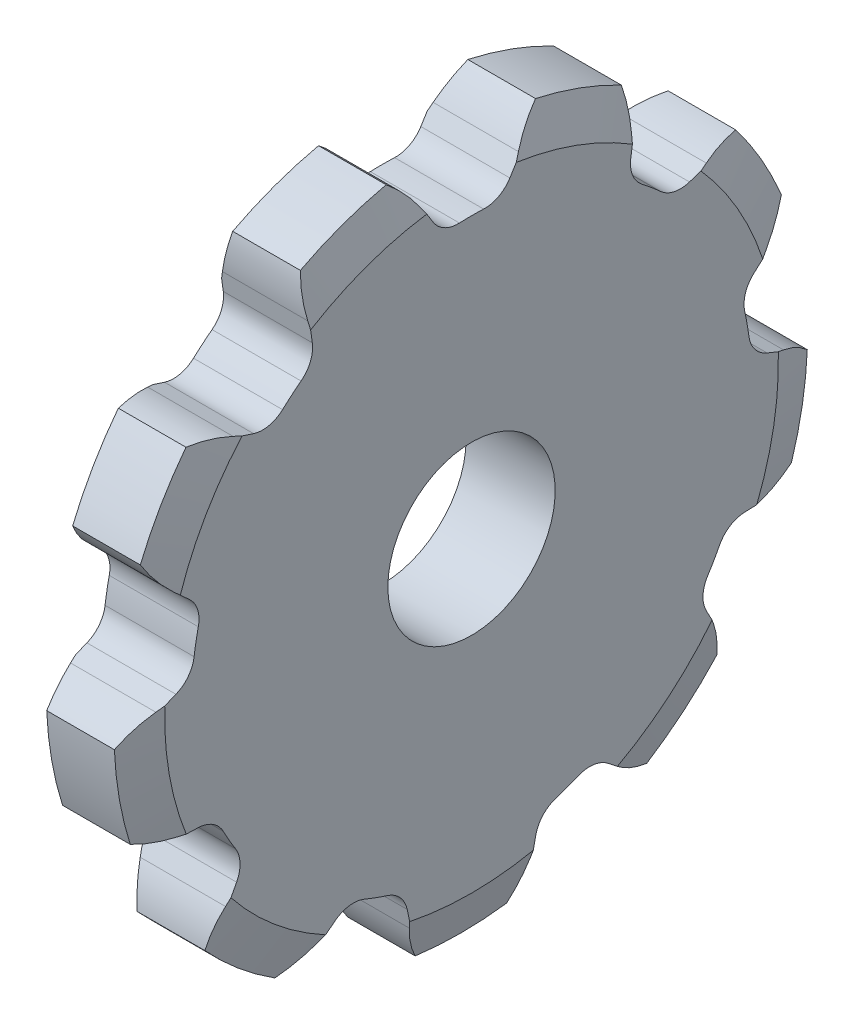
SolidWorks part; units mm, degrees
ref_plane "Plane1" through (0, 0, 0) normal (0, 0, 1) x (1, 0, 0)
ref_plane "Plane2" through (0, 0, 0) normal (0, 1, 0) x (1, 0, 0)
ref_plane "Plane3" through (0, 0, 0) normal (1, 0, 0) x (0, 0, -1)
sketch "Clipboard" plane through (0, 0, 0) normal (0, 1, 0) x (1, 0, 0)
  line L0 (0, 0) -> (65.4527, -10.3667)
  line L1 (-15, 0) -> (100, 0) construction
  line L2 (0, 0) -> (-2.1039, 2.3779)
  line L3 (0, 0) -> (-11.863, 4.5341)
  line L4 (0, 0) -> (8.5297, 1.351)
  line L5 (0, 0) -> (-71.3958, -26.6285)
  line L6 (0, 0) -> (-22.4032, -15.1155)
  line L7 (-2.1039, 2.3779) -> (14.2981, 76.7917)
  line L8 (-76.2, 54.61) -> (-19.7358, 54.61)
  line L9 (-66.6514, 23.5599) -> (-55.7196, 25.8835)
  line L10 (-76.2, 71.12) -> (20.6782, 71.12)
  line L11 (0, 0) -> (-28.448, 0)
  line L12 (-76.2, 101.6) -> (-47.752, 101.6)
  circle A0 centre (0, 0) radius 11.176
  circle A1 centre (0, 0) radius 25.4
  circle A2 centre (0, 0) radius 25.4
  dimension "MHD" = 50.8
  dimension "Hub_dia" = 50.8
  dimension "Diameter" = 22.352
  dimension "Num_teeth" = 9
  dimension "Pitch_radius" = 96.8782
  dimension "Pitch" = 66.2686
  dimension "Width" = 28.448
  dimension "Overall_len" = 76.2
  dimension "Show_teeth" = 9
  dimension "Thickness" = 27.0256
  dimension "OAL" = 76.2001
  dimension "T_dim" = 56.4642
  dimension "Ap" = 12
  dimension "H" = 11.176
  dimension "F" = 28.448
sketch "BasProSke" plane through (0, 0, 0) normal (0, 1, 0) x (1, 0, 0)
  line L0 (-10, 0) -> (60, 0) construction
  line L1 (0, 0) -> (0, 93.1564)
  line L2 (0, 0) -> (27.0256, 0)
  line L3 (27.0256, 0) -> (27.0256, 93.1564)
  line L4 (23.7825, 105.2597) -> (3.2431, 105.2597)
  line L5 (0, 93.1564) -> (3.2431, 105.2597)
  line L6 (27.0256, 93.1564) -> (23.7825, 105.2597)
  dimension "D2" = 15
  dimension "D1" = 15
  dimension "G1" = 3.2431
  dimension "G2" = 3.2431
  dimension "Diameter" = 210.5195
  dimension "Thickness" = 27.0256
revolve "Base-Revolve" add sketch "BasProSke" angle 360 about L0
sketch "TooCutSke" plane through (0, 0, 0) normal (1, 0, 0) x (0, 0, -1)
  line L0 (-11.6391, 89.0554) -> (-14.7996, 94.1133)
  line L1 (0, 0) -> (0, 107) construction
  line L2 (3.3134, 0) -> (3.3134, 129.2389) construction
  line L3 (11.6391, 89.0554) -> (14.7996, 94.1133)
  line L4 (39.8732, 109.5507) -> (44.2168, 121.4848)
  line L5 (3.3134, 101.2907) -> (51.8809, 70.9424) construction
  line L6 (-39.8732, 109.5507) -> (-44.2168, 121.4848)
  arc A0 (3.6705, 84.8609) -> (-3.6705, 84.8609) centre (0, 0) ccw
  arc A1 (3.6705, 84.8609) -> (11.6391, 89.0554) centre (4.0569, 93.7933) ccw
  arc A2 (-3.6705, 84.8609) -> (-11.6391, 89.0554) centre (-4.0569, 93.7933) cw
  circle A3 centre (0, 0) radius 96.8782 construction
  circle A4 centre (3.3134, 96.8215) radius 11.176 construction
  arc A5 (14.7996, 94.1133) -> (39.8732, 109.5507) centre (42.8991, 76.5548) cw
  arc A6 (-14.7996, 94.1133) -> (-39.8732, 109.5507) centre (-42.8991, 76.5548) ccw
  arc A7 (44.2168, 121.4848) -> (-44.2168, 121.4848) centre (0, 0) ccw
  dimension "D1" = 12.7
  dimension "R" = 8.9408
  dimension "Db" = 84.9402
  dimension "H" = 11.176
  dimension "Pitch_radius" = 96.8782
  dimension "Rt" = 33.1343
  dimension "Ag" = 64
  dimension "Cp" = 3.3134
  dimension "Wf" = 5.9642
  dimension "Angle" = 40
extrude "ToothCut" cut sketch "TooCutSke" along normal through all
pattern_circular "TeethCuts" count 9 every 40 about axis through (-10, 0, 0) along (1, 0, 0) of "ToothCut"
sketch "HubNeaOneSke" plane through (0, 0, 0) normal (-1, 0, 0) x (0, 0, 1)
  circle A0 centre (0, 0) radius 25.4
  dimension "Diameter" = 50.8
extrude "HubNearOne" [suppressed] add sketch "HubNeaOneSke" along normal blind 49.1745
sketch "HubNeaBotSke" plane through (0, 0, 0) normal (-1, 0, 0) x (0, 0, 1)
  circle A0 centre (0, 0) radius 25.4
  dimension "Diameter" = 50.8
extrude "HubNearBoth" [suppressed] add sketch "HubNeaBotSke" along normal blind 24.5872
ref_plane "FarPln" through (27.0256, 0, 0) normal (1, 0, 0) x (0, 0, -1)
sketch "HubFarSke" plane through (27.0256, 0, 0) normal (1, 0, 0) x (0, 0, -1)
  circle A0 centre (0, 0) radius 25.4
  dimension "Diameter" = 50.8
extrude "HubFar" [suppressed] add sketch "HubFarSke" along normal blind 24.5872
sketch "BorSke" plane through (0, 0, 0) normal (1, 0, 0) x (0, 0, -1)
  circle A0 centre (0, 0) radius 25.4
  dimension "Diameter" = 50.8
extrude "Bore" cut sketch "BorSke" along normal mid plane 152.4001
sketch "KeySke" plane through (0, 0, 0) normal (1, 0, 0) x (0, 0, -1)
  line L0 (-6.35, 0) -> (-6.35, 31.0642)
  line L1 (-6.35, 31.0642) -> (6.35, 31.0642)
  line L2 (6.35, 31.0642) -> (6.35, 0)
  line L3 (0, 0) -> (0, 34) construction
  line L4 (-6.35, 0) -> (6.35, 0)
  dimension "Offset" = 31.0642
  dimension "Width" = 12.7
extrude "Keyway" [suppressed] cut sketch "KeySke" along normal mid plane 152.4001
pattern_circular "Keyway2" [suppressed] count 2 every 90 about axis through (-10, 0, 0) along (1, 0, 0)
equation "\"Thickness@Clipboard\" = \"Width@Clipboard\" * 0.95"
equation "\"H@Clipboard\" = \"Diameter@Clipboard\" / 2.0"
equation "\"OAL@Clipboard\" = \"Thickness@Clipboard\""
equation "\"Pitch_radius@Clipboard\" = ( \"Pitch@Clipboard\" / 2.0) / sin(3.14159265 / \"Num_teeth@Clipboard\" )"
equation "\"MHD@Clipboard\" = (1.0 / tan(3.14159265 / \"Num_teeth@Clipboard\" ) - 0.05) * \"Pitch@Clipboard\" - \"F@Clipboard\""
equation "\"MHD@Clipboard\" = ((sgn( \"MHD@Clipboard\" - \"Hub_dia@Clipboard\" )-1)*( \"MHD@Clipboard\" - \"Hub_dia@Clipboard\" ))/-2+ \"Hub_dia@Clipboard\""
equation "\"OAL@Clipboard\" = ((sgn( \"OAL@Clipboard\" - \"Overall_len@Clipboard\" )+1)*( \"OAL@Clipboard\" - \"Overall_len@Clipboard\" ))/2 + \"Overall_len@Clipboard\" + 0.000002"
equation "\"Num_teeth@TeethCuts\" = int( \"Show_teeth@Clipboard\" ) + 1"
equation "\"Num_teeth@TeethCuts\" = ((sgn( \"Num_teeth@TeethCuts\" - \"Num_teeth@Clipboard\" )-1)*( \"Num_teeth@TeethCuts\" - \"Num_teeth@Clipboard\" ))/-2+ \"Num_teeth@Clipboard\""
equation "\"Num_teeth@TeethCuts\" = ((sgn( \"Num_teeth@TeethCuts\" - 2.0)+1)*( \"Num_teeth@TeethCuts\" - 2.0))/2 +2.0"
equation "\"Angle@TeethCuts\" = 360.0 / \"Num_teeth@Clipboard\""
equation "\"Pitch_radius@TooCutSke\" = \"Pitch_radius@Clipboard\""
equation "\"Cp@TooCutSke\" = 0.05 * \"Pitch@Clipboard\""
equation "\"Rt@TooCutSke\" = 0.5 * \"Pitch@Clipboard\""
equation "\"R@TooCutSke\"  = 0.8 * \"H@Clipboard\""
equation "\"Db@TooCutSke\" = \"Pitch_radius@Clipboard\" - \"H@Clipboard\" - 0.03"
equation "\"Ag@TooCutSke\" =  2.0 * \"Ap@Clipboard\" + 360.0 / \"Num_teeth@Clipboard\""
equation "\"H@TooCutSke\" = \"H@Clipboard\""
equation "\"Angle@TooCutSke\" =  360.0 / \"Num_teeth@Clipboard\""
equation "\"Wf@TooCutSke\" = 0.01 * \"Pitch@Clipboard\" * \"Num_teeth@Clipboard\""
equation "\"Wf@TooCutSke\" = ((sgn( \"Wf@TooCutSke\" - \"H@Clipboard\" * 0.8 )-1)*( \"Wf@TooCutSke\" - \"H@Clipboard\" * 0.8 ))/-2+ \"H@Clipboard\" * 0.8"
equation "\"Diameter@BasProSke\" = (1.0 / tan(3.14159265 / \"Num_teeth@Clipboard\" )) * \"Pitch@Clipboard\" + \"F@Clipboard\""
equation "\"Thickness@BasProSke\"  = \"Thickness@Clipboard\""
equation "\"G1@BasProSke\" =  \"Thickness@Clipboard\" * 0.12"
equation "\"G2@BasProSke\" =   \"Thickness@Clipboard\" * 0.12"
equation "\"MHD@Clipboard\" = ((sgn( \"MHD@Clipboard\" - \"Db@TooCutSke\" * 2.0  )-1)*( \"MHD@Clipboard\" - \"Db@TooCutSke\" * 2.0 ))/-2+ \"Db@TooCutSke\" * 2.0"
equation "\"Diameter@HubNeaOneSke\" = \"MHD@Clipboard\""
equation "\"Length@HubNearOne\" = \"OAL@Clipboard\" - \"Thickness@BasProSke\""
equation "\"Diameter@HubNeaBotSke\" = \"MHD@Clipboard\""
equation "\"Length@HubNearBoth\" = ( \"OAL@Clipboard\" - \"Thickness@BasProSke\" ) / 2.0"
equation "\"Thickness@FarPln\" = \"Thickness@BasProSke\""
equation "\"Diameter@HubFarSke\" = \"MHD@Clipboard\""
equation "\"Length@HubFar\" = ( \"OAL@Clipboard\" - \"Thickness@BasProSke\" ) / 2.0"
equation "\"D1@Bore\" = \"OAL@Clipboard\" * 2.0"
equation "\"D1@Keyway\" = \"OAL@Clipboard\" * 2.0"
equation "\"Offset@KeySke\" = \"T_dim@Clipboard\" - \"Diameter@BorSke\" / 2.0"
